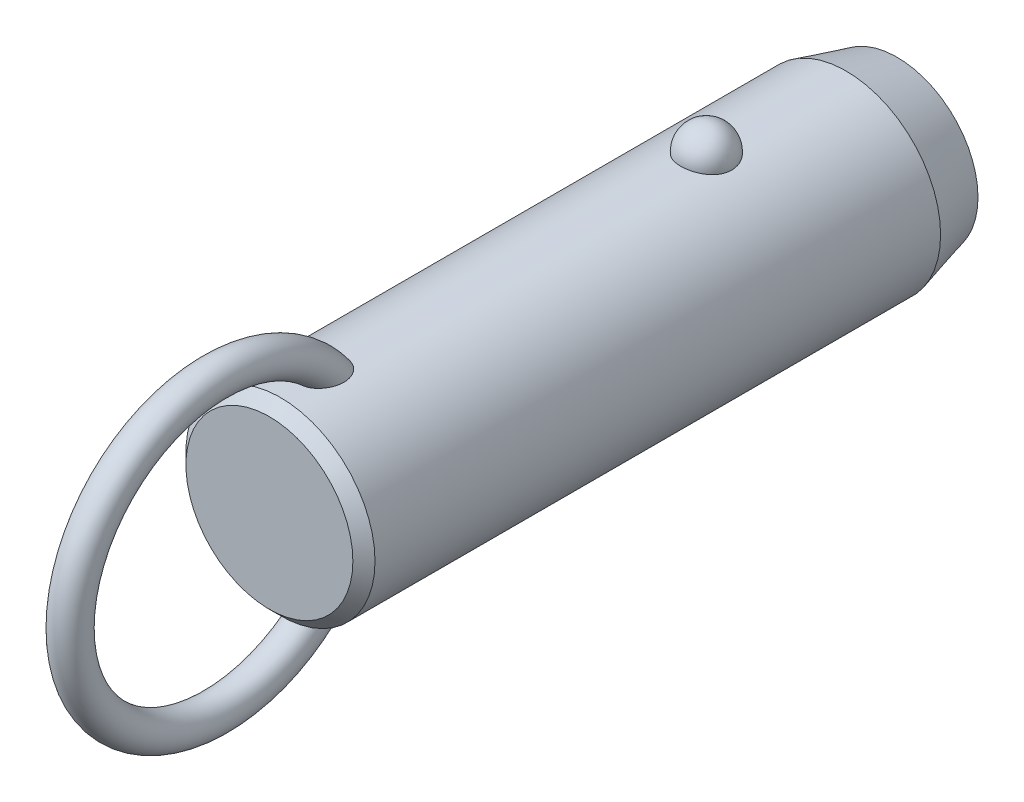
SolidWorks part; units mm, degrees
ref_plane "Front Plane" through (0, 0, 0) normal (0, 0, 1) x (1, 0, 0)
ref_plane "Top Plane" through (0, 0, 0) normal (0, 1, 0) x (1, 0, 0)
ref_plane "Right Plane" through (0, 0, 0) normal (1, 0, 0) x (0, 0, -1)
sketch "Sketch2" plane through (0, 0, 0) normal (0, 0, 1) x (1, 0, 0)
  circle A0 centre (0, 0) radius 11.1
  point P3 (0, 11.1)
  dimension "D1" = 22.2
extrude "Boss-Extrude1" add sketch "Sketch2" along normal blind 35.6
sketch "Sketch3" plane through (0, 0, 0) normal (0, 0, -1) x (-1, 0, 0)
  circle A0 centre (0, 0) radius 11.1
  dimension "D1" = 22.2
extrude "Boss-Extrude2" add sketch "Sketch3" along normal blind 25.4
chamfer "Chamfer1" distance 6 angle 15 1 edges at (-11.1, 0, -25.4)
sketch "Sketch12" plane through (0, 0, 0) normal (1, 0, 0) x (0, 0, -1)
  line L0 (-35.6, 11.1) -> (-35.6, -11.1) construction
  point P0 (-35.6, 0)
sketch "Sketch13" plane through (0, 0, 0) normal (1, 0, 0) x (0, 0, -1)
  circle A0 centre (-54.65, 0) radius 19.05
  point P2 (-35.6, 0)
  dimension "D1" = 38.1
sketch "Sketch14" plane through (0, 0, 0) normal (0, 1, 0) x (1, 0, 0)
  circle A0 centre (0, -37.6) radius 2
  point P2 (0, -35.6)
  dimension "D1" = 4
sweep "Sweep1" add profiles "Sketch14" path "Sketch13"
sketch "Sketch15" plane through (0, 0, 35.6) normal (0, 0, 1) x (1, 0, 0)
  circle A0 centre (0, 0) radius 11.1
  dimension "D1" = 22.2
extrude "Boss-Extrude3" add sketch "Sketch15" along normal blind 12.7
chamfer "Chamfer2" distance 1.3 angle 45 1 edges at (11.1, 0, 48.3)
sketch "Sketch18" plane through (0, 0, 0) normal (1, 0, 0) x (0, 0, -1)
  line L0 (19.4, 11.1) -> (-39.168, 11.1) construction
  line L1 (3, 14.1) -> (3, 8.1)
  line L2 (-39.168, -11.1) -> (19.4, -11.1) construction
  arc A0 (3, 14.1) -> (3, 8.1) centre (3, 11.1) ccw
  point P4 (0, 11.1)
  dimension "D1" = 25.2
revolve "Revolve1" add sketch "Sketch18" angle 360 about L1
